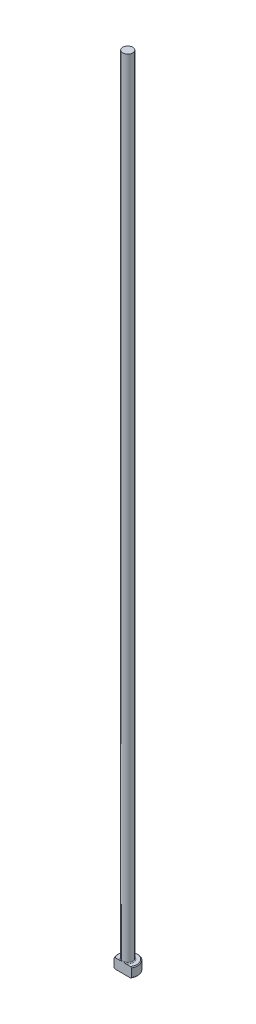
SolidWorks part; units mm, degrees
ref_plane "Front Plane" through (0, 0, 0) normal (0, 0, 1) x (1, 0, 0)
ref_plane "Top Plane" through (0, 0, 0) normal (0, 1, 0) x (1, 0, 0)
ref_plane "Right Plane" through (0, 0, 0) normal (1, 0, 0) x (0, 0, -1)
sketch "Sketch1" plane through (0, 0, 0) normal (0, 0, 1) x (1, 0, 0)
  line L0 (0, 259.9588) -> (0, -15.1925) construction
  line L1 (0, 0) -> (-3.175, 0)
  line L2 (-3.175, 0) -> (-3.175, 3.175)
  line L3 (-3.175, 3.175) -> (-1.5875, 3.175)
  line L4 (-1.5875, 3.175) -> (-1.5875, 254)
  line L5 (-1.5875, 254) -> (0, 254)
  line L6 (0, 254) -> (0, 0)
  dimension "L" = 254
  dimension "H" = 6.35
  dimension "T" = 3.175
  dimension "D" = 3.175
revolve "Revolve1" add sketch "Sketch1" angle 360 about L0
chamfer "Chamfer1" distance 0.254 angle 45 2 edges at (0, 3.175, 3.175) (0, 0, 3.175)
fillet "Fillet1" radius 0.254 1 edges at (0, 3.175, 1.5875)
sketch "Sketch2" plane through (0, 0, 0) normal (0, 1, 0) x (1, 0, 0)
  line L0 (-2.7496, -1.5875) -> (2.7496, -1.5875)
  circle A0 centre (0, 0) radius 3.175 construction
  arc A1 (-2.7496, -1.5875) -> (2.7496, -1.5875) centre (0, 0) ccw
  circle A3 centre (0, 0) radius 1.5875 construction
  dimension "D1" = 0
extrude "Key" cut sketch "Sketch2" along normal through all
sketch "Pocket Sketch" plane through (0, 0, 0) normal (0, 0, 1) x (1, 0, 0)
  line L0 (-3.5719, 0) -> (-3.5719, 3.2004)
  line L1 (-3.5719, 3.2004) -> (-2.5479, 3.2004)
  line L2 (-1.7859, 3.9624) -> (-1.7859, 22.225)
  line L3 (-1.7859, 22.225) -> (0, 22.225)
  line L4 (0, 22.225) -> (0, 0)
  line L5 (0, 0) -> (-3.5719, 0)
  line L6 (0, 12.6104) -> (0, -2.4989) construction
  line L7 (-3.175, 2.921) -> (-3.175, 0.254) construction
  line L8 (2.921, 3.175) -> (-2.921, 3.175) construction
  line L9 (-1.5875, 254) -> (-1.5875, 3.429) construction
  line L10 (-2.5479, 3.2004) -> (-1.7859, 3.9624)
  point P3 (-1.7859, 3.2004)
  dimension "D1" = 7.1437
  dimension "D2" = 0.3969
  dimension "D3" = 0.0254
  dimension "D4" = 0.1984
  dimension "D5" = 3.5719
  dimension "D6" = 22.225
